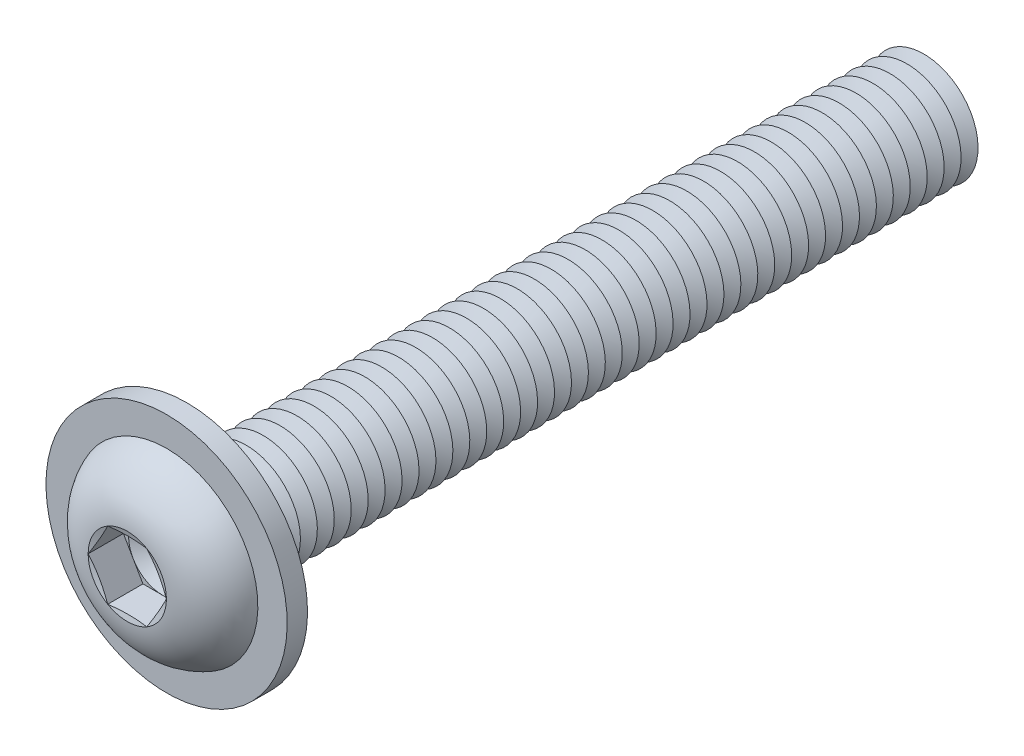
SolidWorks part; units mm, degrees
ref_plane "Front Plane" through (0, 0, 0) normal (0, 0, 1) x (1, 0, 0)
ref_plane "Top Plane" through (0, 0, 0) normal (0, 1, 0) x (1, 0, 0)
ref_plane "Right Plane" through (0, 0, 0) normal (1, 0, 0) x (0, 0, -1)
sketch "Sketch1" plane through (0, 0, 0) normal (1, 0, 0) x (0, 0, -1)
  line L0 (0, 4) -> (0, 7)
  line L3 (0, 4) -> (55, 4)
  line L4 (55, 4) -> (55, 0)
  line L5 (55, 0) -> (-4.4, 0) construction
  line L6 (-4.4, 0) -> (55, 0)
  line L7 (-4.4, 2.8867) -> (-4.4, 1.4434) construction
  line L8 (-4.4, 1.4434) -> (-4.4, 0)
  line L9 (-4.4, 2.8867) -> (-4.0132, 1.4434)
  line L10 (-4.0132, 1.4434) -> (-4.4, 1.4434)
  line L11 (55, 0) -> (22.7481, 0) construction
  line L12 (0, 7) -> (-4.4, 7) construction
  arc A1 (0, 7) -> (-4.4, 2.8867) centre (0, 2.59) ccw
  point P8 (55, 2)
  dimension "D1" = 14
  dimension "D2" = 8
  dimension "D3" = 4.4
  dimension "D4" = 5.7735
  dimension "D5" = 55
  dimension "D6" = 15
revolve "Revolve1" add sketch "Sketch1" angle 360 about L5
fillet "Fillet1" radius 0.625 1 edges at (0, 4, 0)
sketch "Sketch2" plane through (0, 0, 0) normal (1, 0, 0) x (0, 0, -1)
  line L0 (54.375, 4) -> (55.625, 4)
  line L1 (55, 4) -> (0.625, 4) construction
  line L2 (55.625, 4) -> (55, 2.9175)
  line L3 (55, -4) -> (55, 4) construction
  line L4 (55, 2.9175) -> (54.375, 4)
  dimension "D1" = 1.25
revolve "Cut-Revolve1" cut sketch "Sketch2" angle 360 about axis through (0, 0, -55) along (0, 0, -1)
pattern_linear "LPattern1" count 44 spacing 1.25 along (0, 0, 1) of "Cut-Revolve1"
sketch "Sketch3" plane through (0, 0, 4.4) normal (0, 0, 1) x (1, 0, 0)
  line L7 (1.4434, 2.5) -> (-1.4434, 2.5)
  line L8 (-1.4434, 2.5) -> (-2.8867, 0)
  line L9 (-2.8867, 0) -> (-1.4434, -2.5)
  line L10 (-1.4434, -2.5) -> (1.4434, -2.5)
  line L11 (1.4434, -2.5) -> (2.8867, 0)
  line L12 (2.8867, 0) -> (1.4434, 2.5)
  circle A0 centre (0, 0) radius 2.5 construction
  circle A3 centre (0, 0) radius 2.8867 construction
extrude "Cut-Extrude1" cut sketch "Sketch3" against normal blind 2.6
sketch "Sketch4" plane through (0, 0, 1.8) normal (0, 0, 1) x (1, 0, 0)
  line L1 (1.4434, 2.5) -> (-1.4434, 2.5) construction
  circle A0 centre (0, 0) radius 2.5
extrude "Cut-Extrude2" cut sketch "Sketch4" against normal through all draft 60
sketch "Sketch5" plane through (0, 0, 0) normal (0, 0, -1) x (-1, 0, 0)
  circle A0 centre (0, 0) radius 8.9
  circle A1 centre (0, 0) radius 4.625
  circle A2 centre (0, 0) radius 4.625 construction
  dimension "D1" = 17.8
extrude "Boss-Extrude1" add sketch "Sketch5" against normal blind 1.5
